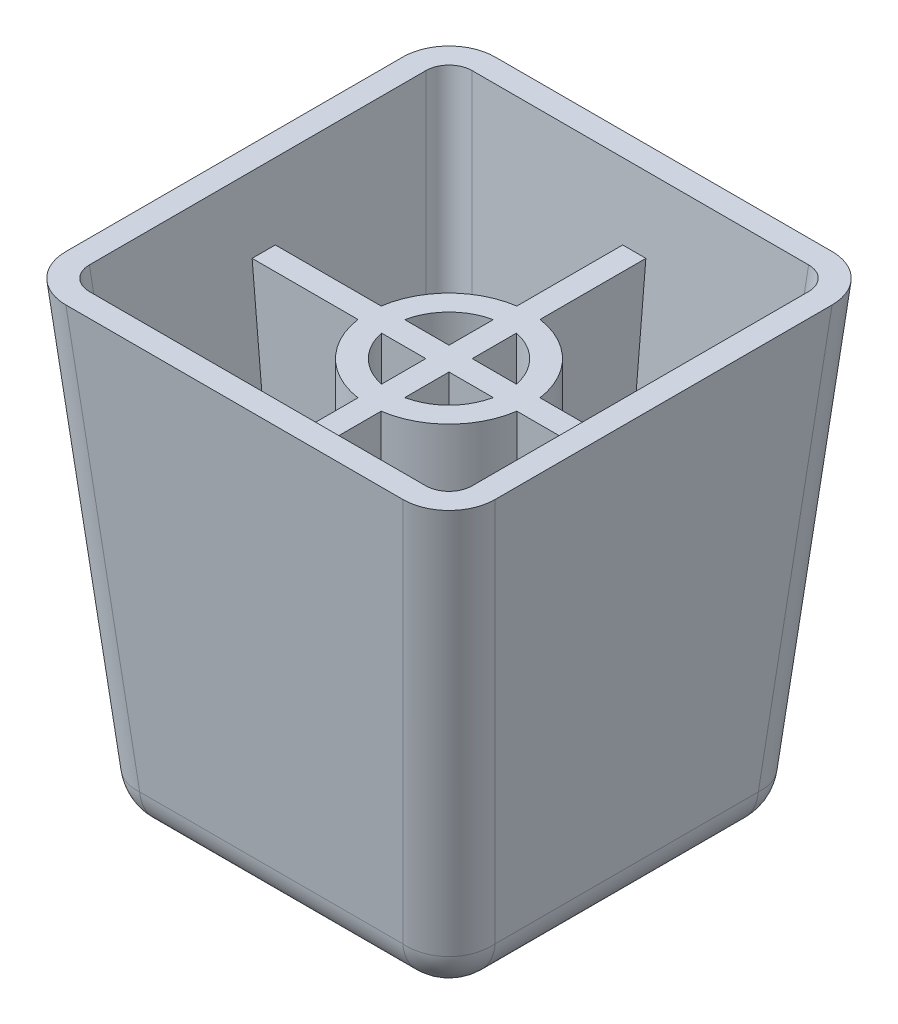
SolidWorks part; units mm, degrees
ref_plane "Front" through (0, 0, 0) normal (0, 0, 1) x (1, 0, 0)
ref_plane "Top" through (0, 0, 0) normal (0, 1, 0) x (1, 0, 0)
ref_plane "Right" through (0, 0, 0) normal (1, 0, 0) x (0, 0, -1)
sketch "Sketch1" plane through (0, 0, 0) normal (0, 1, 0) x (1, 0, 0)
  line L1 (37.5, 37.5) -> (-37.5, 37.5)
  line L2 (-37.5, 37.5) -> (-37.5, -37.5)
  line L3 (-37.5, -37.5) -> (37.5, -37.5)
  line L4 (37.5, -37.5) -> (37.5, 37.5)
  circle A0 centre (0, 0) radius 37.5 construction
  dimension "D1" = 75
extrude "Base-Extrude" add sketch "Sketch1" along normal blind 100 draft 5
fillet "Fillet1" radius 10 8 edges at (0, 0, 37.5) (-37.5, 0, 0) (0, 0, -37.5) (37.5, 0, 0) (41.8744, 50, 41.8744) (-41.8744, 50, 41.8744) (-41.8744, 50, -41.8744) (41.8744, 50, -41.8744)
shell "Shell1" thickness 5
ref_plane "Rib Plane" through (0, 85, 0) normal (0, 1, 0) x (-1, 0, 0)
sketch "Sketch2" plane through (0, 85, 0) normal (0, 1, 0) x (-1, 0, 0)
  line L0 (0, -21.2661) -> (0, 21.6265)
  line L1 (24.1496, 0) -> (-23.0683, 0)
  circle A0 centre (0, 0) radius 14.7957
rib "Rib1" sketch "Sketch2" sketch "Sketch2" thickness 5 extrusion direction normal to sketch draft on no parameters "D1"=5
